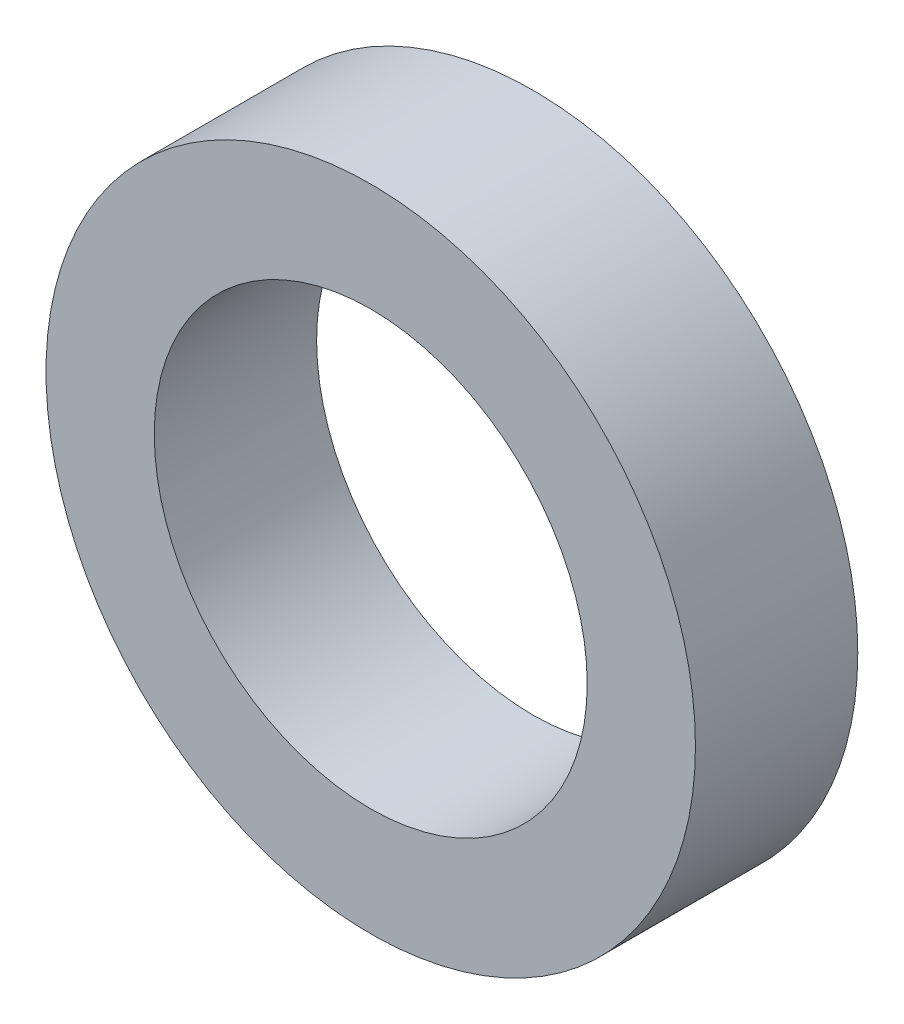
SolidWorks part; units mm, degrees
ref_plane "Plan de face" through (0, 0, 0) normal (0, 0, 1) x (1, 0, 0)
ref_plane "Plan de dessus" through (0, 0, 0) normal (0, 1, 0) x (1, 0, 0)
ref_plane "Plan de droite" through (0, 0, 0) normal (1, 0, 0) x (0, 0, -1)
sketch "Esquisse1" plane through (0, 0, 0) normal (0, 0, 1) x (1, 0, 0)
  circle A0 centre (0, 0) radius 4
  circle A1 centre (0, 0) radius 6
  dimension "D1" = 8
  dimension "D2" = 12
extrude "Boss.-Extru.1" add sketch "Esquisse1" along normal blind 3
